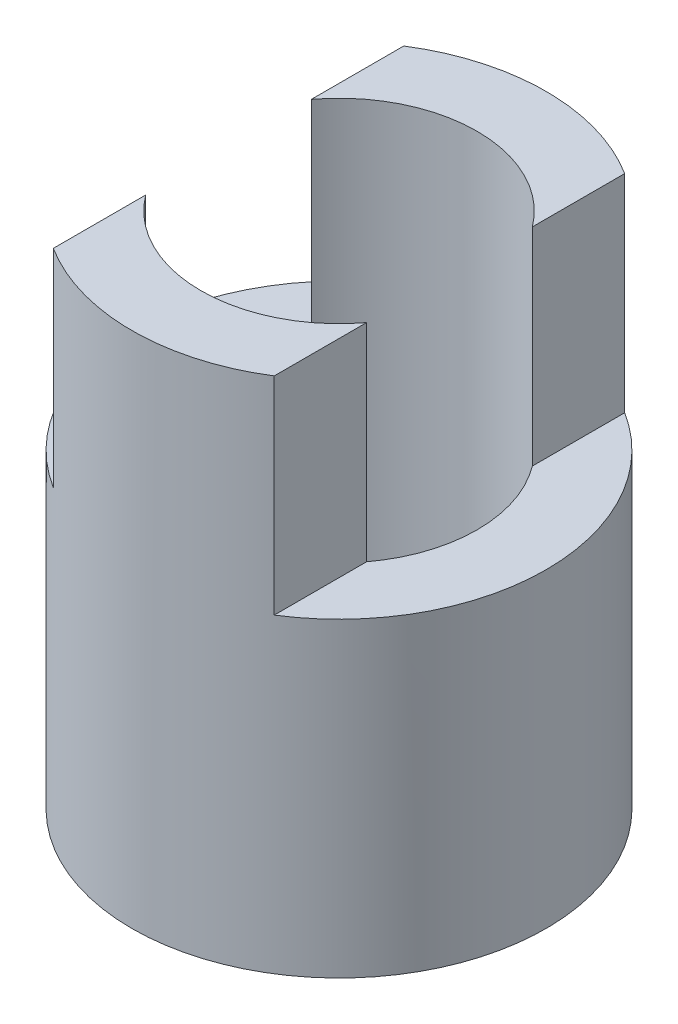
SolidWorks part; units mm, degrees
ref_plane "前视基准面" through (0, 0, 0) normal (0, 0, 1) x (1, 0, 0)
ref_plane "上视基准面" through (0, 0, 0) normal (0, 1, 0) x (1, 0, 0)
ref_plane "右视基准面" through (0, 0, 0) normal (1, 0, 0) x (0, 0, -1)
sketch "草图1" plane through (0, 0, 0) normal (0, 1, 0) x (1, 0, 0)
  circle A0 centre (0, 0) radius 30
  circle A1 centre (0, 0) radius 20
  dimension "D1" = 60
  dimension "D2" = 40
extrude "拉伸1" add sketch "草图1" along normal blind 75
sketch "草图2" plane through (0, 75, 0) normal (0, 1, 0) x (1, 0, 0)
  line L0 (-16, -25.3772) -> (-16, 25.3772)
  line L1 (16, 25.3772) -> (16, -25.3772)
  line L2 (0, -54.7492) -> (0, 49.3514) construction
  arc A0 (16, -25.3772) -> (16, 25.3772) centre (0, 0) ccw
  circle A1 centre (0, 0) radius 30
  arc A2 (-16, 25.3772) -> (-16, -25.3772) centre (0, 0) ccw
  dimension "D2" = 32
  dimension "D1" = 0
extrude "切除-拉伸1" cut sketch "草图2" against normal blind 30
